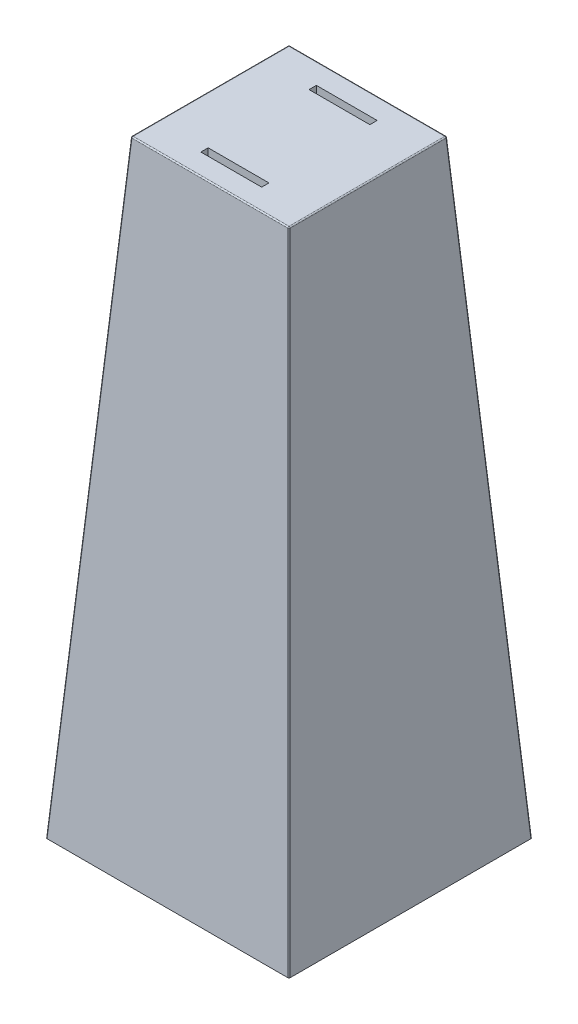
SolidWorks part; units mm, degrees
ref_plane "Front Plane" through (0, 0, 0) normal (0, 0, 1) x (1, 0, 0)
ref_plane "Top Plane" through (0, 0, 0) normal (0, 1, 0) x (1, 0, 0)
ref_plane "Right Plane" through (0, 0, 0) normal (1, 0, 0) x (0, 0, -1)
sketch "Sketch1" plane through (0, 0, -400) normal (0, -1, 0) x (1, 0, 0)
  line L0 (0, 335) -> (0, 465) construction
  line L1 (65, 465) -> (-65, 465)
  line L2 (65, 465) -> (65, 335)
  line L3 (65, 335) -> (-65, 335)
  line L4 (-65, 465) -> (-65, 335)
  dimension "D1" = 130
extrude "Extrude höjd" add sketch "Sketch1" along normal blind 500 draft 4
fillet "Fillet kantavrundning" radius 1 8 edges at (0, 0, -65) (-65, 0, 0) (0, 0, 65) (65, 0, 0) (82.4817, -250, -82.4817) (-82.4817, -250, -82.4817) (-82.4817, -250, 82.4817) (82.4817, -250, 82.4817)
sketch "Sketch2" plane through (0, 0, 0) normal (0, -1, 0) x (0, 0, -1)
  line L4 (47.5, 25) -> (41.5, 25) construction
  line L5 (47.5, -25) -> (47.5, 25) construction
  line L6 (47.5, -25) -> (41.5, -25) construction
  line L7 (41.5, -25) -> (41.5, 25) construction
  line L8 (-41.5, -25) -> (-41.5, 25) construction
  line L9 (-41.5, 25) -> (-47.5, 25) construction
  line L10 (-41.5, -25) -> (-47.5, -25) construction
  line L11 (-47.5, -25) -> (-47.5, 25) construction
  line L12 (47.5, 25) -> (41.5, 25)
  line L13 (47.5, -25) -> (47.5, 25)
  line L14 (47.5, -25) -> (41.5, -25)
  line L15 (41.5, -25) -> (41.5, 25)
  line L16 (-41.5, -25) -> (-41.5, 25)
  line L17 (-41.5, 25) -> (-47.5, 25)
  line L18 (-41.5, -25) -> (-47.5, -25)
  line L19 (-47.5, -25) -> (-47.5, 25)
extrude "Cut hål" cut sketch "Sketch2" along normal blind 200
